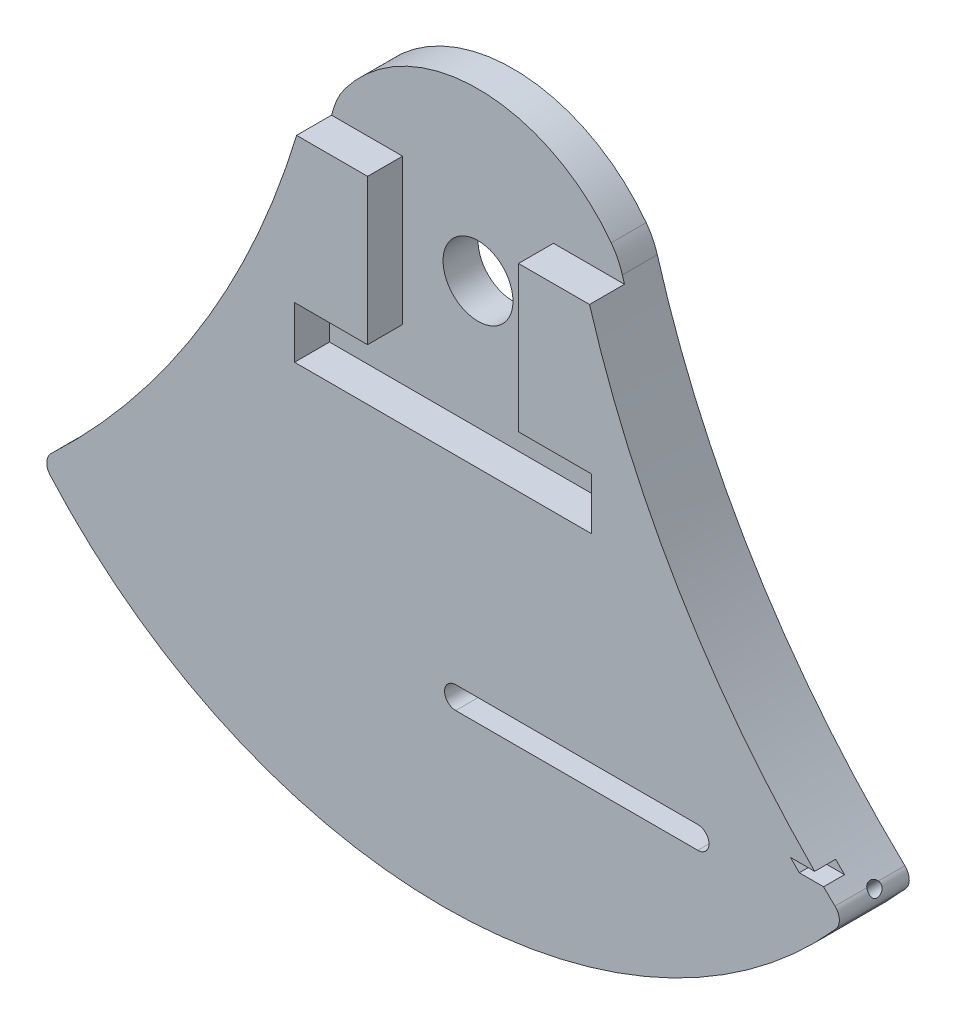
SolidWorks part; units mm, degrees
ref_plane "Front Plane" through (0, 0, 0) normal (0, 0, 1) x (1, 0, 0)
ref_plane "Top Plane" through (0, 0, 0) normal (0, 1, 0) x (1, 0, 0)
ref_plane "Right Plane" through (0, 0, 0) normal (1, 0, 0) x (0, 0, -1)
sketch "Sketch1" plane through (0, 0, 0) normal (0, 0, 1) x (1, 0, 0)
  line L0 (0, 0) -> (0, 60) construction
  line L1 (-53.033, -53.033) -> (0, 0) construction
  line L2 (0, 60) -> (16, 60) construction
  line L3 (0, 60) -> (0, 50) construction
  line L4 (0, 60) -> (-16, 60) construction
  line L5 (0, 0) -> (0, -95.7808) construction
  line L6 (0, 0) -> (53.033, -53.033) construction
  line L8 (-64.561, -58.9899) -> (67.8775, -58.9899) construction
  line L9 (-21.2432, 10.0603) -> (-10.7929, 10.0603) construction
  line L10 (-10.7929, 10.0603) -> (-10.7929, -10.7929) construction
  line L11 (-10.7929, -10.7929) -> (-21.2412, -10.7929) construction
  line L12 (-21.2412, -10.7929) -> (-21.2412, -18.1924) construction
  line L13 (21.2412, -10.7929) -> (21.2412, -18.1924) construction
  line L14 (10.7929, -10.7929) -> (21.2412, -10.7929) construction
  line L15 (10.7929, 10.0603) -> (10.7929, -10.7929) construction
  line L16 (21.2432, 10.0603) -> (10.7929, 10.0603) construction
  line L17 (-21.2412, -18.1924) -> (21.2412, -18.1924) construction
  line L18 (-63.2289, -53.033) -> (63.2289, -53.033) construction
  line L19 (0, 0) -> (-57.4533, -48.2091) construction
  line L20 (0, 0) -> (57.4533, -48.2091) construction
  circle A0 centre (0, 0) radius 5 construction
  arc A1 (-57.4533, -48.2091) -> (-16, 60) centre (-145.6998, 47.6415) ccw
  arc A2 (57.4533, -48.2091) -> (16, 60) centre (145.6998, 47.6415) cw
  arc A3 (-16, 60) -> (16, 60) centre (0, 58.8889) cw
  arc A5 (57.4533, -48.2091) -> (-57.4533, -48.2091) centre (0, 0) cw
  point P20 (0, -106.066)
  dimension "D1" = 10
  dimension "D2" = 75
  dimension "D3" = 60
  dimension "D4" = 5
  dimension "D5" = 5
extrude "Body" add sketch "Sketch1" along normal blind 10
sketch "Sketch2" plane through (0, 0, 10) normal (0, 0, 1) x (1, 0, 0)
  circle A0 centre (0, 0) radius 5
  dimension "D1" = 10
extrude "Attachment Hole" cut sketch "Sketch2" against normal through all
sketch "Sketch17" plane through (0, 0, 10) normal (0, 0, 1) x (1, 0, 0)
  line L0 (-21.2432, 10.0603) -> (-10.7929, 10.0603)
  line L1 (-10.7929, 10.0603) -> (-10.7929, -10.7929)
  line L2 (-10.7929, -10.7929) -> (-21.2412, -10.7929)
  line L3 (-21.2412, -10.7929) -> (-21.2412, -18.1924)
  line L4 (-21.2412, -18.1924) -> (21.2412, -18.1924)
  line L5 (21.2412, -18.1924) -> (21.2412, -10.7929)
  line L6 (21.2412, -10.7929) -> (10.7929, -10.7929)
  line L7 (10.7929, -10.7929) -> (10.7929, 10.0603)
  line L8 (10.7929, 10.0603) -> (21.2432, 10.0603)
  line L9 (0, 0) -> (0, 42.2888) construction
  line L10 (0, 0) -> (0, 60) construction
  arc A0 (-21.2432, 10.0603) -> (-16.9187, 27.8879) centre (-174.7002, 56.723) ccw
  arc A1 (-57.4533, -48.2091) -> (-16, 60) centre (-145.6998, 47.6415) ccw construction
  arc A2 (21.2432, 10.0603) -> (16.9187, 27.8879) centre (174.7002, 56.723) cw
  arc A3 (-16.9187, 27.8879) -> (16.9187, 27.8879) centre (0, 10.9692) cw
sketch "Sketch20" plane through (0, 0, 10) normal (0, 0, 1) x (1, 0, 0)
  arc A0 (-57.4533, -48.2091) -> (57.4533, -48.2091) centre (0, 0) ccw construction
  point P0 (0, -75)
ref_plane "Plane1" through (0, -75, 10) normal (0, -1, 0) x (-1, 0, 0)
ref_plane "Plane2" through (0, -58.9899, 0) normal (0, -1, 0) x (-1, 0, 0)
sketch "Sketch21" plane through (0, -58.9899, 0) normal (0, -1, 0) x (-1, 0, 0)
  line L0 (-57.4533, -10) -> (57.4533, -10) construction
  line L1 (-53.5312, -6.1608) -> (-60.3001, -6.1608) construction
  line L2 (-60.3001, -6.1608) -> (-60.3001, -3.8392) construction
  line L3 (-60.3001, -3.8392) -> (-53.5312, -3.8392) construction
  line L4 (-53.5312, -3.8392) -> (-53.5312, -6.1608) construction
  line L5 (-53.5312, -5) -> (-60.3001, -5) construction
  circle A0 centre (53.297, -5.3768) radius 0.9038
  dimension "D3" = 1.8076
  dimension "D2" = 5
sketch "Sketch22" plane through (0, -75, 10) normal (0, -1, 0) x (-1, 0, 0)
  line L4 (51.4588, 8.1358) -> (51.4588, 1.7252)
  line L5 (51.4588, 1.7252) -> (-59.5848, 1.7252)
  line L6 (-59.5848, 1.7252) -> (-59.5848, 8.1358)
  line L7 (-59.5848, 8.1358) -> (51.4588, 8.1358)
wrap "Wrap1" sketch "Sketch22" wrap type deboss source sketch "Sketch22" thickness 3 parameters "D1"=3
sketch "Sketch23" plane through (0, 0, 10) normal (0, 0, 1) x (1, 0, 0)
  line L0 (-57.4533, -48.2091) -> (57.4533, -48.2091) construction
  line L1 (1.8121, -48.2091) -> (36.4412, -48.2091) construction
  line L2 (1.8121, -46.6091) -> (36.4412, -46.6091)
  line L3 (1.8121, -49.8091) -> (36.4412, -49.8091)
  arc A0 (1.8121, -46.6091) -> (1.8121, -49.8091) centre (1.8121, -48.2091) ccw
  arc A1 (36.4412, -49.8091) -> (36.4412, -46.6091) centre (36.4412, -48.2091) ccw
  point P6 (19.1266, -48.2091)
  dimension "D1" = 3.2
fillet "Fillet3" radius 2 1 edges at (-57.4533, -48.2091, 5)
fillet "Fillet4" radius 2 1 edges at (57.4533, -48.2091, 5)
extrude "Horiz Slot" cut sketch "Sketch23" against normal through all
sketch "Sketch26" plane through (0, 0, 10) normal (0, 0, 1) x (1, 0, 0)
  line L0 (54.4274, -45.3322) -> (50.9516, -45.3322)
  line L1 (54.4274, -45.3322) -> (53.1505, -44.0613)
  line L2 (53.1505, -44.0613) -> (49.7, -44.0613)
  line L3 (49.7, -44.0613) -> (50.9516, -45.3322)
  arc A0 (16, 60) -> (56.0605, -46.9078) centre (145.6998, 47.6415) ccw construction
extrude "Cut-Extrude15" cut sketch "Sketch26" against normal blind 3
sketch "Sketch27" plane through (0, 0, 10) normal (0, 0, 1) x (1, 0, 0)
  arc A0 (-20.2314, 12.5351) -> (-16, 60) centre (-145.6998, 47.6415) ccw
  arc A1 (-16, 60) -> (16, 60) centre (0, 58.8889) cw
  arc A2 (16, 60) -> (20.2314, 12.5351) centre (145.6998, 47.6415) ccw
  arc A3 (-20.2314, 12.5351) -> (20.2314, 12.5351) centre (0, 0) cw
  arc A4 (-56.0605, -46.9078) -> (-16, 60) centre (-145.6998, 47.6415) ccw construction
  arc A5 (16, 60) -> (53.1505, -44.0613) centre (145.6998, 47.6415) ccw construction
  dimension "D1" = 23.8
extrude "Cut-Extrude16" cut sketch "Sketch27" against normal through all
extrude "Cut-Extrude17" cut sketch "Sketch17" against normal blind 5
sketch "Sketch29" plane through (0, 0, 10) normal (0, 0, 1) x (1, 0, 0)
  line L0 (-70.3279, -28.5857) -> (12.4268, -28.5857) construction
ref_plane "Plane3" through (0, -28.5857, 0) normal (0, -1, 0) x (-1, 0, 0)
fillet "Fillet5" radius 10 2 edges at (20.2314, 12.5351, 2.5) (-20.2314, 12.5351, 2.5)
sketch "Sketch31" plane through (0, 0, 0) normal (-0.7007, -0.7135, 0) x (0.7135, -0.7007, 0)
  circle A0 centre (73.324, 4.6195) radius 0.95
  dimension "D1" = 1.9
extrude "Cut-Extrude24" cut sketch "Sketch31" against normal through all
extrude "Cut-Extrude25" cut sketch "Sketch21" against normal through all contours A0
sketch "Sketch32" plane through (0, -58.9899, 0) normal (0, -1, 0) x (-1, 0, 0)
  circle A0 centre (53.297, -6.3768) radius 1.7
sketch "Sketch33" plane through (0, -28.5857, 0) normal (0, -1, 0) x (-1, 0, 0)
  circle A0 centre (53.297, -5.3768) radius 1.625
  dimension "D1" = 3.25
extrude "Cut-Extrude27" cut sketch "Sketch33" along normal blind 22.35
